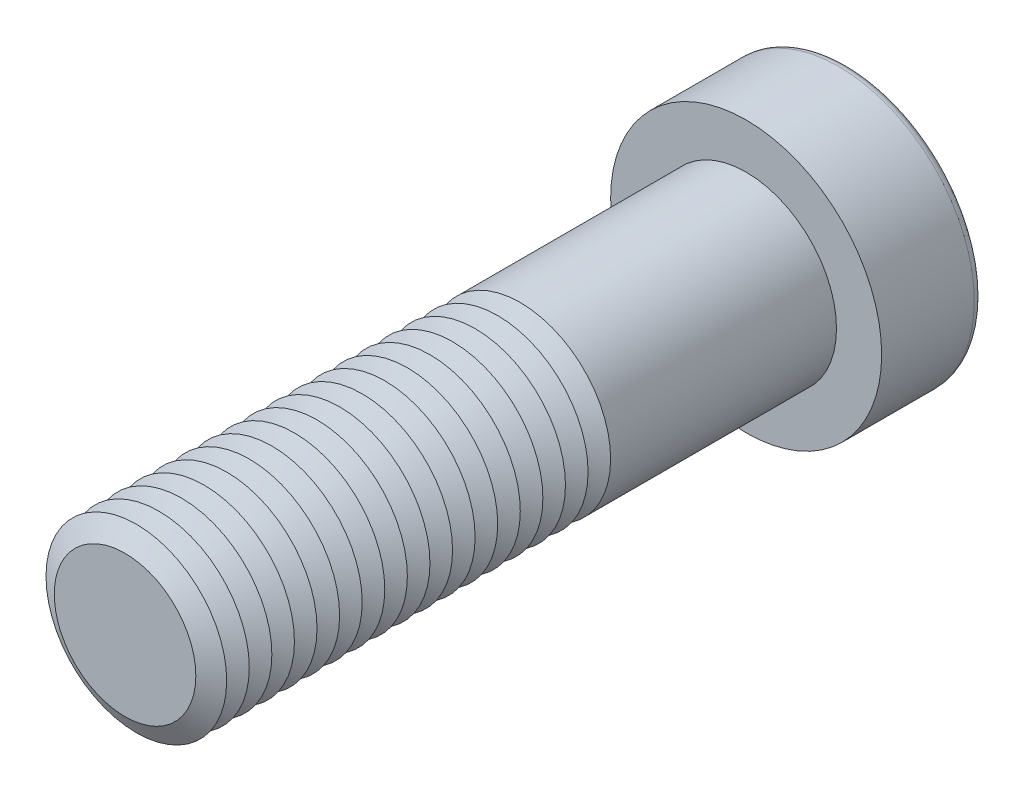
SolidWorks part; units mm, degrees
ref_plane "Front Plane" through (0, 0, 0) normal (0, 0, 1) x (1, 0, 0)
ref_plane "Top Plane" through (0, 0, 0) normal (0, 1, 0) x (1, 0, 0)
ref_plane "Right Plane" through (0, 0, 0) normal (1, 0, 0) x (0, 0, -1)
sketch "Sketch1" plane through (0, 0, 0) normal (0, 0, 1) x (1, 0, 0)
  circle A0 centre (0, 0) radius 8
  dimension "D1" = 16
extrude "Boss-Extrude1" add sketch "Sketch1" along normal blind 55
sketch "Sketch2" plane through (0, 0, 0) normal (0, 0, -1) x (-1, 0, 0)
  circle A0 centre (0, 0) radius 12
  dimension "D1" = 24
extrude "Boss-Extrude2" add sketch "Sketch2" along normal blind 9
sketch "Sketch3" plane through (0, 0, -9) normal (0, 0, -1) x (-1, 0, 0)
  line L1 (-3.4641, 6) -> (-6.9282, 0)
  line L2 (-6.9282, 0) -> (-3.4641, -6)
  line L3 (-3.4641, -6) -> (3.4641, -6)
  line L4 (3.4641, -6) -> (6.9282, 0)
  line L5 (6.9282, 0) -> (3.4641, 6)
  line L6 (3.4641, 6) -> (-3.4641, 6)
  circle A0 centre (0, 0) radius 6 construction
  dimension "D1" = 12
extrude "Cut-Extrude1" cut sketch "Sketch3" against normal blind 9
fillet "Fillet1" radius 0.8 1 edges at (-12, 0, -9)
sketch "Sketch4" plane through (0, 0, 0) normal (0, 0, -1) x (-1, 0, 0)
  line L0 (3.4641, -6) -> (6.9282, 0) construction
  circle A0 centre (0, 0) radius 6
extrude "Cut-Extrude2" cut sketch "Sketch4" against normal through all draft 60
sketch "Sketch5" plane through (0, 0, -9) normal (0, 0, -1) x (-1, 0, 0)
  circle A0 centre (0, 0) radius 6.9282
extrude "Cut-Extrude3" cut sketch "Sketch5" against normal through all draft 75
sketch "Sketch7" plane through (0, 0, 0) normal (1, 0, 0) x (0, 0, -1)
  line L25 (-55, 6.2679) -> (-54, 8)
  line L26 (-55, 8) -> (-55, -8) construction
  line L27 (-54, 8) -> (-56, 8)
  line L28 (-56, 8) -> (-55, 6.2679)
  line L29 (0, 8) -> (-55, 8) construction
  dimension "D1" = 2
revolve "Cut-Revolve1" cut sketch "Sketch7" angle 360 about axis through (0, 0, 55) along (0, 0, -1)
pattern_linear "LPattern1" count 18 spacing 2 along (0, 0, -1) of "Cut-Revolve1"
